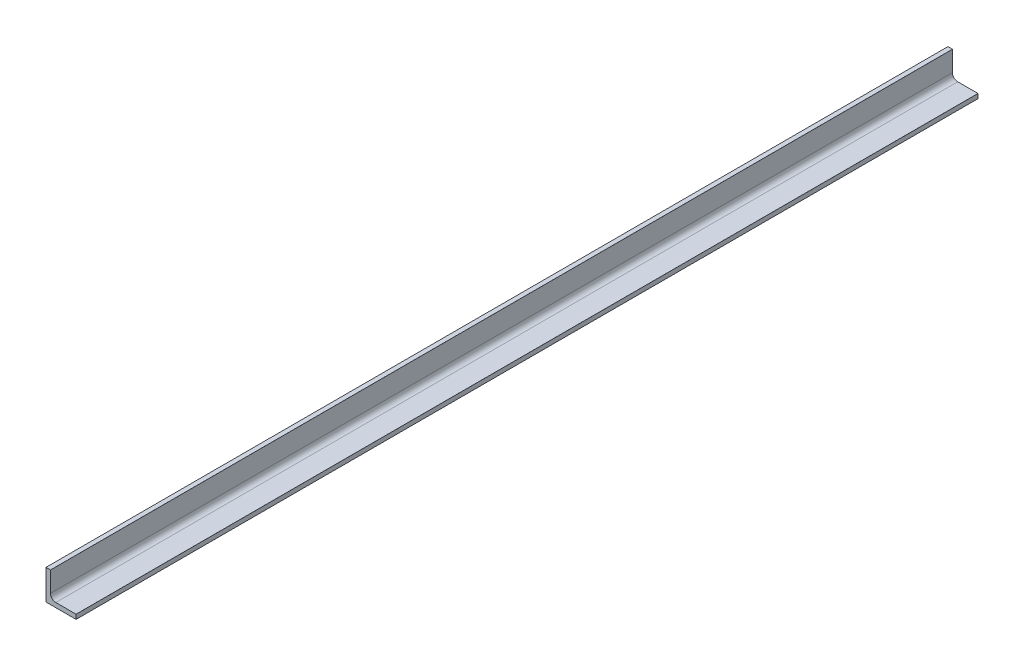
SolidWorks part; units mm, degrees
ref_plane "前视基准面" through (0, 0, 0) normal (0, 0, 1) x (1, 0, 0)
ref_plane "上视基准面" through (0, 0, 0) normal (0, 1, 0) x (1, 0, 0)
ref_plane "右视基准面" through (0, 0, 0) normal (1, 0, 0) x (0, 0, -1)
sketch "草图1" plane through (0, 0, 0) normal (0, 0, 1) x (1, 0, 0)
  line L0 (0, 0) -> (0, 20)
  line L1 (0, 20) -> (2.99, 20)
  line L2 (3, 19.99) -> (3, 6.5)
  line L3 (6.5, 3) -> (19.99, 3)
  line L4 (20, 2.99) -> (20, 0)
  line L5 (20, 0) -> (0, 0)
  arc A0 (3, 19.99) -> (2.99, 20) centre (2.99, 19.99) ccw
  arc A1 (6.5, 3) -> (3, 6.5) centre (6.5, 6.5) cw
  arc A2 (20, 2.99) -> (19.99, 3) centre (19.99, 2.99) ccw
  point P9 (3, 20)
  point P14 (20, 3)
  dimension "D5" = 0.01
  dimension "D6" = 3.5
  dimension "D7" = 0.01
  dimension "D1" = 20
  dimension "D2" = 20
  dimension "D3" = 3
  dimension "D4" = 3
extrude "拉伸1" add sketch "草图1" along normal blind 600
sketch "草图2" plane through (0, 0, 0) normal (0, 1, 0) x (1, 0, 0)
  line L0 (0, 0) -> (0, -600)
  dimension "D1" = 600
equation "\"D2@草图1\" = \"D1@草图1\""
equation "\"D4@草图1\" = \"D3@草图1\""
equation "\"D7@草图1\" = \"D5@草图1\""
equation "\"D1@草图2\" = \"D1@拉伸1\""
